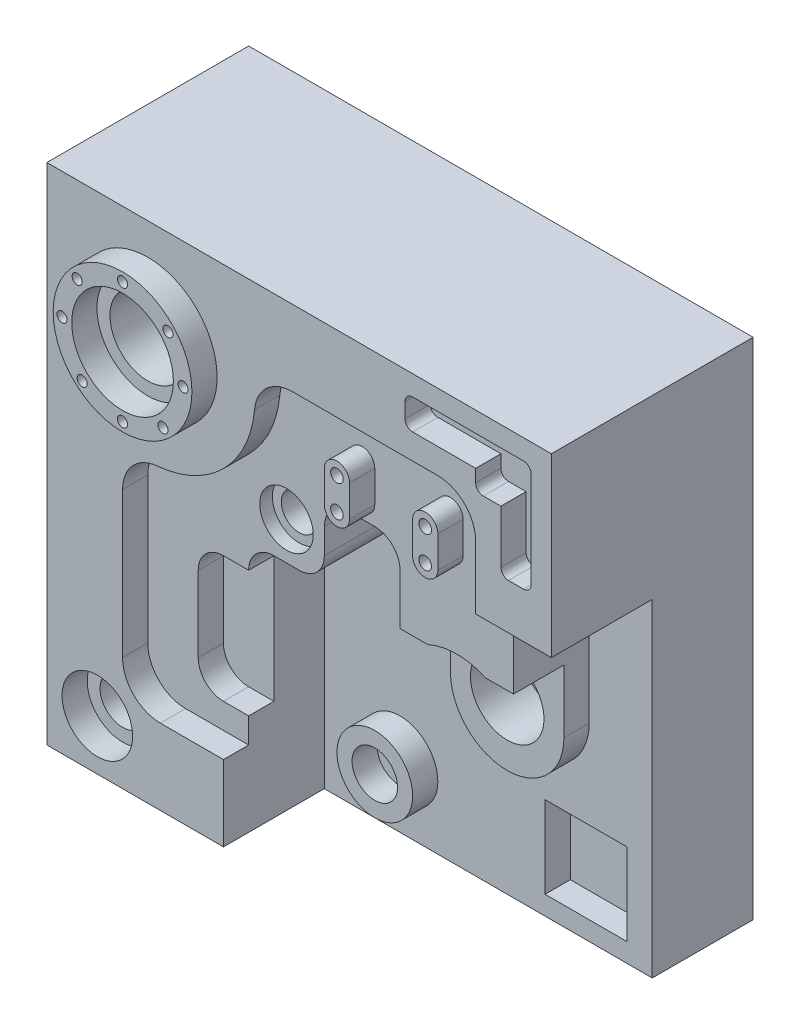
SolidWorks part; units mm, degrees
ref_plane "Plane1" through (0, 0, 0) normal (0, 0, 1) x (1, 0, 0)
ref_plane "Plane2" through (0, 0, 0) normal (0, 1, 0) x (1, 0, 0)
ref_plane "Plane3" through (0, 0, 0) normal (1, 0, 0) x (0, 0, -1)
sketch "Sketch1" plane through (0, 0, 0) normal (0, 0, 1) x (1, 0, 0)
  line L0 (-100, 100) -> (100, 100)
  line L1 (-100, 100) -> (-100, -100)
  line L2 (100, -100) -> (-100, -100)
  line L3 (100, -100) -> (100, 100)
  dimension "D1" = 200
  dimension "D2" = 200
  dimension "D3" = 100
  dimension "D4" = 100
extrude "Base-Extrude" add sketch "Sketch1" against normal blind 80
sketch "Sketch2" plane through (0, 0, 0) normal (0, 0, 1) x (1, 0, 0)
  line L1 (-55, -70) -> (70, -70)
  line L2 (70, 55) -> (70, -70)
  line L3 (55, 70) -> (-2.7178, 70)
  line L4 (-70, 2.7178) -> (-70, -55)
  arc A0 (-56.3043, 17.661) -> (-70, 2.7178) centre (-55, 2.7178) ccw
  arc A1 (-56.3043, 17.661) -> (-17.661, 56.3043) centre (-60, 60) ccw
  arc A2 (-2.7178, 70) -> (-17.661, 56.3043) centre (-2.7178, 55) ccw
  arc A3 (70, 55) -> (55, 70) centre (55, 55) ccw
  arc A4 (-55, -70) -> (-70, -55) centre (-55, -55) cw
  dimension "D1" = 42.5
  dimension "D6" = 15
  dimension "D7" = 15
  dimension "D8" = 15
  dimension "D9" = 15
  dimension "D2" = 140
  dimension "D3" = 140
  dimension "D4" = 70
  dimension "D5" = 70
extrude "Cut-Extrude1" cut sketch "Sketch2" against normal blind 10
sketch "Sketch3" plane through (0, 0, -10) normal (0, 0, 1) x (1, 0, 0)
  circle A0 centre (-60, 60) radius 27.5
  dimension "D1" = 55
  dimension "D2" = 60
  dimension "D3" = 60
extrude "Boss-Extrude4" add sketch "Sketch3" along normal blind 20
sketch "Sketch4" plane through (0, 0, -10) normal (0, 0, 1) x (1, 0, 0)
  line L0 (-30, -100) -> (-30, -10)
  line L1 (100, -100) -> (-100, -100) construction
  line L2 (-20, 0) -> (-10, 0)
  line L3 (0, 10) -> (0, 20)
  line L4 (10, 30) -> (20, 30)
  line L5 (30, 20) -> (30, -10)
  line L6 (30, -10) -> (75, -10)
  line L7 (75, -10) -> (75, 20)
  line L8 (85, 30) -> (100, 30)
  line L9 (-30, -100) -> (100, -100)
  line L10 (100, 30) -> (100, -100)
  arc A0 (-20, 0) -> (-30, -10) centre (-20, -10) ccw
  arc A1 (0, 10) -> (-10, 0) centre (-10, 10) cw
  arc A2 (10, 30) -> (0, 20) centre (10, 20) ccw
  arc A3 (30, 20) -> (20, 30) centre (20, 20) ccw
  arc A4 (85, 30) -> (75, 20) centre (85, 20) ccw
  dimension "D1" = 10
extrude "Cut-Extrude3" cut sketch "Sketch4" against normal blind 30 and the other way blind 30
sketch "Sketch5" plane through (0, 0, 0) normal (0, 0, 1) x (1, 0, 0)
  line L0 (100, 30) -> (70, 30)
  line L1 (100, 30) -> (100, -30)
  line L2 (70, -30) -> (100, -30)
  line L3 (70, -30) -> (70, 30)
extrude "Cut-Extrude6" cut sketch "Sketch5" against normal blind 10
sketch "Sketch6" plane through (0, 0, -40) normal (0, 0, 1) x (1, 0, 0)
  circle A0 centre (52.5, -25) radius 22.5
  dimension "D3" = 45
  dimension "D1" = 52.5
  dimension "D2" = 25
extrude "Cut-Extrude9" cut sketch "Sketch6" along normal blind 40
sketch "Sketch7" plane through (0, 0, 0) normal (0, 0, 1) x (1, 0, 0)
  line L0 (75, -25) -> (75, 0)
  line L1 (75, 20) -> (75, -10) construction
  line L2 (30, -25) -> (30, 0)
  line L3 (30, 20) -> (30, -10) construction
  line L4 (30, 0) -> (75, 0)
  arc A0 (30, -25) -> (75, -25) centre (52.5, -25) ccw
extrude "Boss-Extrude8" add sketch "Sketch7" against normal blind 40
sketch "Sketch8" plane through (0, 0, 0) normal (0, 0, 1) x (1, 0, 0)
  line L0 (75, -25) -> (75, 0)
  line L1 (30, -25) -> (30, 0)
  line L2 (30, 0) -> (75, 0)
  arc A0 (30, -25) -> (75, -25) centre (52.5, -25) ccw
extrude "Cut-Extrude10" cut sketch "Sketch8" against normal blind 30
sketch "Sketch9" plane through (0, 0, 0) normal (0, 0, 1) x (1, 0, 0)
  circle A0 centre (52.5, -25) radius 27.5
extrude "Cut-Extrude14" cut sketch "Sketch9" against normal blind 30
sketch "Sketch11" plane through (0, 0, -10) normal (0, 0, 1) x (1, 0, 0)
  line L0 (-40, -10) -> (-30, -10)
  line L1 (-50, -20) -> (-50, -50)
  line L2 (-30, -60) -> (-40, -60)
  line L3 (-30, -60) -> (-30, -10)
  arc A0 (-40, -10) -> (-50, -20) centre (-40, -20) ccw
  arc A1 (-50, -50) -> (-40, -60) centre (-40, -50) ccw
extrude "Cut-Extrude17" cut sketch "Sketch11" against normal blind 10
sketch "Sketch13" plane through (0, 0, -10) normal (0, 0, 1) x (1, 0, 0)
  circle A0 centre (-15, 15) radius 10.6066
extrude "Cut-Extrude20" cut sketch "Sketch13" against normal blind 5
sketch "Sketch14" plane through (0, 0, -15) normal (0, 0, 1) x (1, 0, 0)
  circle A0 centre (-15, 15) radius 7.0711
extrude "Cut-Extrude21" cut sketch "Sketch14" against normal blind 30
sketch "Sketch16" plane through (0, 0, -30) normal (0, 0, 1) x (1, 0, 0)
  circle A0 centre (52.5, -22.5) radius 14.5774
extrude "Cut-Extrude23" cut sketch "Sketch16" against normal blind 20
sketch "Sketch17" plane through (0, 0, 10) normal (0, 0, 1) x (1, 0, 0)
  circle A0 centre (-60, 60) radius 20.1556
extrude "Cut-Extrude24" cut sketch "Sketch17" against normal blind 10
sketch "Sketch18" plane through (0, 0, 0) normal (0, 0, 1) x (1, 0, 0)
  circle A0 centre (-60, 60) radius 15
extrude "Cut-Extrude25" cut sketch "Sketch18" against normal blind 60
sketch "Sketch19" plane through (0, 0, -40) normal (0, 0, 1) x (1, 0, 0)
  circle A0 centre (0, -75) radius 15
extrude "Boss-Extrude9" add sketch "Sketch19" along normal blind 10
sketch "Sketch20" plane through (0, 0, -30) normal (0, 0, 1) x (1, 0, 0)
  circle A0 centre (0, -75) radius 9.0139
extrude "Cut-Extrude26" cut sketch "Sketch20" against normal blind 10
sketch "Sketch21" plane through (0, 0, -40) normal (0, 0, 1) x (1, 0, 0)
  circle A0 centre (0, -75) radius 5
extrude "Cut-Extrude27" cut sketch "Sketch21" against normal blind 30
sketch "Sketch23" plane through (0, 0, -40) normal (0, 0, 1) x (1, 0, 0)
  line L0 (57.5, -60) -> (90, -60)
  line L1 (57.5, -60) -> (57.5, -92.5)
  line L2 (90, -92.5) -> (57.5, -92.5)
  line L3 (90, -92.5) -> (90, -60)
extrude "Cut-Extrude29" cut sketch "Sketch23" against normal blind 10
sketch "Sketch25" plane through (0, 0, -10) normal (0, 0, 1) x (1, 0, 0)
  line L0 (20, 50) -> (20, 37.5)
  line L1 (10, 50) -> (10, 37.5)
  line L2 (55, 50) -> (55, 37.5)
  line L3 (45, 50) -> (45, 37.5)
  arc A0 (20, 50) -> (10, 50) centre (15, 50) ccw
  arc A1 (10, 37.5) -> (20, 37.5) centre (15, 37.5) ccw
  arc A3 (55, 50) -> (45, 50) centre (50, 50) ccw
  arc A4 (45, 37.5) -> (55, 37.5) centre (50, 37.5) ccw
extrude "Boss-Extrude11" add sketch "Sketch25" along normal blind 10
sketch "Sketch26" plane through (0, 0, 0) normal (0, 0, 1) x (1, 0, 0)
  circle A0 centre (15, 50) radius 2.5
  circle A1 centre (15, 37.5) radius 2.5
  circle A2 centre (50, 50) radius 2.5
  circle A3 centre (50, 37.5) radius 2.5
extrude "Cut-Extrude30" cut sketch "Sketch26" against normal blind 30
sketch "Sketch27" plane through (0, 0, 0) normal (0, 0, 1) x (1, 0, 0)
  circle A0 centre (-36, 60) radius 2
  circle A1 centre (-84, 60) radius 2
  circle A2 centre (-60, 84) radius 2
  circle A3 centre (-60, 36) radius 2
  circle A4 centre (-42, 76) radius 2
  circle A5 centre (-78, 76) radius 2
  circle A6 centre (-44, 42) radius 2
  circle A7 centre (-76, 42) radius 2
extrude "Cut-Extrude34" cut sketch "Sketch27" against normal blind 10 and the other way blind 10
sketch "Sketch28" plane through (0, 0, 0) normal (0, 0, 1) x (1, 0, 0)
  circle A0 centre (-80, -80) radius 14
extrude "Cut-Extrude35" cut sketch "Sketch28" against normal blind 10
sketch "Sketch29" plane through (0, 0, -10) normal (0, 0, 1) x (1, 0, 0)
  circle A0 centre (-80, -80) radius 8.9443
extrude "Cut-Extrude36" cut sketch "Sketch29" against normal blind 10
sketch "Sketch30" plane through (0, 0, 0) normal (0, 0, 1) x (1, 0, 0)
  line L0 (70, 92) -> (92, 92)
  line L1 (70, 92) -> (70, 72)
  line L2 (92, 72) -> (70, 72)
  line L3 (92, 72) -> (92, 92)
extrude "Cut-Extrude37" cut sketch "Sketch30" against normal blind 10
sketch "Sketch31" plane through (0, 0, 0) normal (0, 0, 1) x (1, 0, 0)
  line L0 (80, 76) -> (92, 76)
  line L1 (80, 76) -> (80, 48)
  line L2 (92, 48) -> (80, 48)
  line L3 (92, 48) -> (92, 76)
extrude "Cut-Extrude38" cut sketch "Sketch31" against normal blind 10
sketch "Sketch32" plane through (0, 0, 0) normal (0, 0, 1) x (1, 0, 0)
  line L0 (80, 80) -> (42, 80)
  line L1 (80, 80) -> (80, 92)
  line L2 (42, 92) -> (80, 92)
  line L3 (42, 92) -> (42, 80)
extrude "Cut-Extrude39" cut sketch "Sketch32" against normal blind 10
fillet "Fillet1" radius 3 6 edges at (70, 72, -5) (92, 92, -5) (80, 48, -5) (92, 48, -5) (42, 92, -5) (42, 80, -5)
